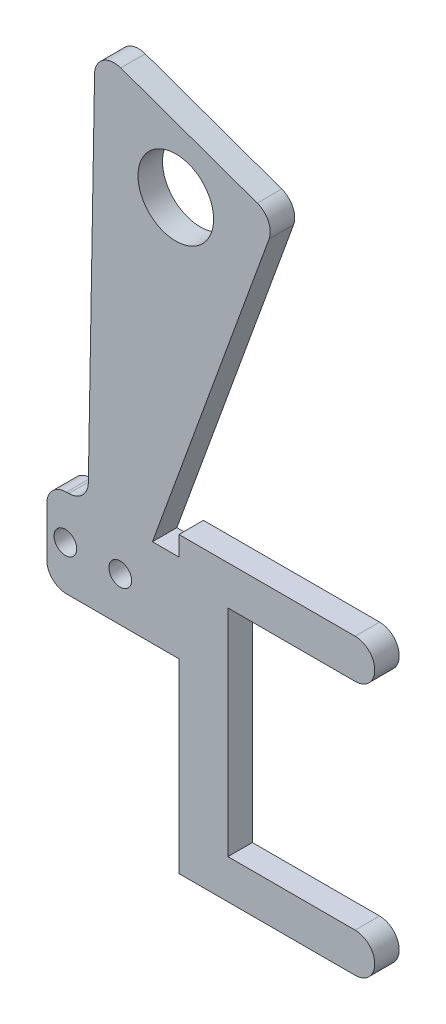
SolidWorks part; units mm, degrees
ref_plane "Front Plane" through (0, 0, 0) normal (0, 0, 1) x (1, 0, 0)
ref_plane "Top Plane" through (0, 0, 0) normal (0, 1, 0) x (1, 0, 0)
ref_plane "Right Plane" through (0, 0, 0) normal (1, 0, 0) x (0, 0, -1)
sketch "Sketch6" plane through (0, 0, 0) normal (0, 0, 1) x (1, 0, 0)
  line L0 (13.97, 11.43) -> (36.83, 11.43) construction
  line L1 (36.83, 13.97) -> (13.97, 13.97)
  line L2 (20.32, 8.89) -> (36.83, 8.89)
  line L3 (0, 11.43) -> (13.97, 11.43)
  line L4 (13.97, -21.59) -> (36.83, -21.59) construction
  line L5 (13.97, -24.13) -> (36.83, -24.13)
  line L6 (20.32, -19.05) -> (36.83, -19.05)
  line L7 (20.32, 8.89) -> (20.32, -19.05)
  line L8 (13.97, 11.43) -> (13.97, 13.97)
  line L10 (13.97, -24.13) -> (13.97, 0)
  line L11 (13.97, 0) -> (0, 0)
  line L12 (0, 11.43) -> (0, 0)
  arc A0 (36.83, 8.89) -> (36.83, 13.97) centre (36.83, 11.43) ccw
  arc A1 (36.83, -19.05) -> (36.83, -24.13) centre (36.83, -21.59) cw
  dimension "D2" = 2.54
  dimension "D4" = 11.43
  dimension "D7" = 2.54
  dimension "D1" = 6.35
  dimension "D3" = 5.08
  dimension "D5" = 38.1
  dimension "D6" = 13.97
  dimension "D8" = 5.08
  dimension "D9" = 22.86
extrude "Boss-Extrude3" add sketch "Sketch6" along normal blind 3.175
sketch "Sketch9" plane through (0, 0, 0) normal (0, 0, 1) x (1, 0, 0)
  line L1 (2.1728, 11.43) -> (10.5272, 11.43)
  line L2 (2.1728, 11.43) -> (3.087, 63.8026)
  line L3 (3.087, 63.8026) -> (26.5365, 55.4153)
  line L4 (10.5272, 11.43) -> (26.5365, 55.4153)
  line L5 (20.32, 8.89) -> (36.83, 8.89) construction
  line L6 (13.97, 11.43) -> (0, 11.43) construction
  line L8 (0, 0) -> (13.97, 0) construction
  line L9 (0, 11.43) -> (-3.175, 11.43)
  line L10 (0, 11.43) -> (0, 0)
  line L11 (0, 0) -> (-3.175, 0)
  line L12 (-3.175, 11.43) -> (-3.175, 0)
  point P7 (6.35, 11.43)
  dimension "D1" = 70
  dimension "D2" = 3.175
  dimension "D3" = 89
  dimension "D7" = 6.35
extrude "Boss-Extrude4" add sketch "Sketch9" along normal blind 3.175
hole_wizard "#4 Clearance Hole1" positions "Sketch8" profile "Sketch7" hole size "#4" standard "ANSI Inch"
sketch "Sketch8" plane through (0, 0, 3.175) normal (0, 0, 1) x (1, 0, 0)
  line L1 (-3.175, 11.43) -> (-3.175, 0) construction
  line L4 (2.1728, 11.43) -> (10.5272, 11.43) construction
  point P0 (-0.762, 5.715)
  point P3 (6.35, 5.715)
  point P11 (-3.175, 5.715)
  point P29 (6.35, 11.43)
  dimension "D2" = 7.112
sketch "Sketch7" plane through (-0.762, 5.715, 3.175) normal (1, 0, 0) x (0, -1, 0)
  line L0 (0, 0) -> (0, 3.175)
  line L1 (0, 3.175) -> (1.4732, 3.175)
  line L2 (1.4732, 3.175) -> (1.4732, 0)
  line L5 (1.4732, 0) -> (0, 0)
  line L11 (0, -6.35) -> (0, 107.95) construction
  dimension "Thru Hole Dia." = 2.9464
  dimension "Thru Hole Depth" = 3.175
hole_wizard "3/8 Clearance Hole1" positions "Sketch11" profile "Sketch10" hole size "3/8" standard "ANSI Inch"
sketch "Sketch11" plane through (0, 0, 3.175) normal (0, 0, 1) x (1, 0, 0)
  line L0 (14.8118, 59.609) -> (6.35, 5.715) construction
  line L1 (26.5365, 55.4153) -> (3.087, 63.8026) construction
  point P0 (13.5586, 51.6273)
  dimension "D1" = 7.9375
sketch "Sketch10" plane through (13.5586, 51.6273, 3.175) normal (1, 0, 0) x (0, -1, 0)
  line L0 (0, 0) -> (0, 3.175)
  line L1 (0, 3.175) -> (4.9022, 3.175)
  line L2 (4.9022, 3.175) -> (4.9022, 0)
  line L5 (4.9022, 0) -> (0, 0)
  line L11 (0, -6.35) -> (0, 107.95) construction
  dimension "Thru Hole Dia." = 9.8044
  dimension "Thru Hole Depth" = 3.175
fillet "Fillet1" radius 2.54 4 edges at (26.5365, 55.4153, 1.5875) (3.087, 63.8026, 1.5875) (-3.175, 0, 1.5875) (-3.175, 11.43, 1.5875)
fillet "Fillet2" radius 2.54 1 edges at (2.1728, 11.43, 1.5875)
